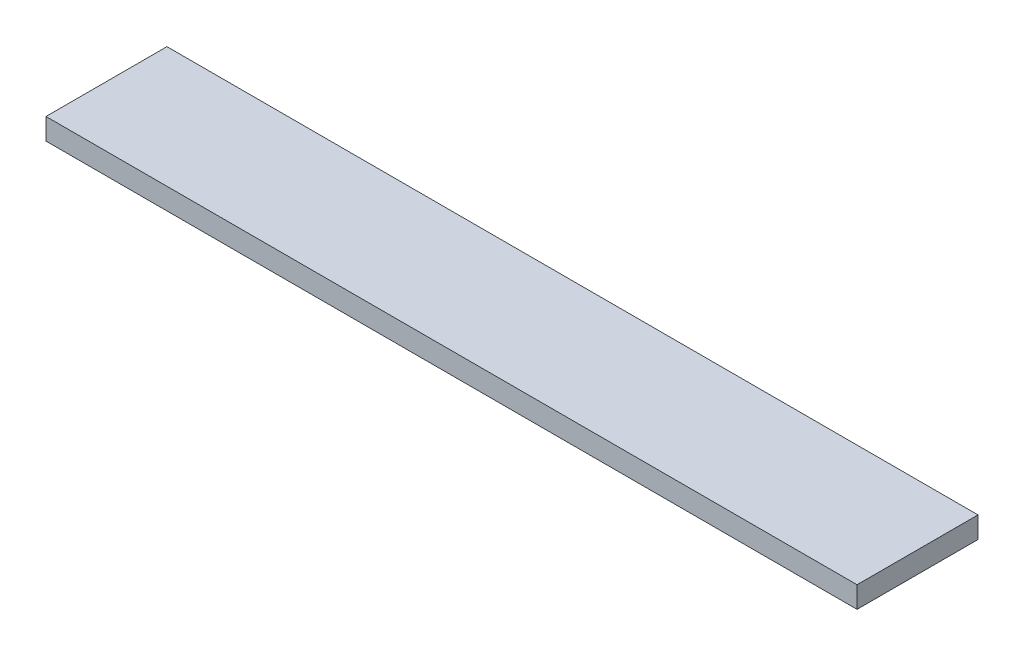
SolidWorks part; units mm, degrees
ref_plane "Alzado" through (0, 0, 0) normal (0, 0, 1) x (1, 0, 0)
ref_plane "Planta" through (0, 0, 0) normal (0, 1, 0) x (1, 0, 0)
ref_plane "Vista lateral" through (0, 0, 0) normal (1, 0, 0) x (0, 0, -1)
sketch "Croquis2" plane through (0, 0, 0) normal (0, 1, 0) x (1, 0, 0)
  line L1 (-285, 42.5) -> (285, 42.5)
  line L2 (-285, 42.5) -> (-285, -42.5)
  line L3 (-285, -42.5) -> (285, -42.5)
  line L4 (285, 42.5) -> (285, -42.5)
  line L5 (-285, 42.5) -> (285, -42.5) construction
  line L6 (-285, -42.5) -> (285, 42.5) construction
  point P0 (0, 0)
  dimension "D1" = 570
  dimension "D2" = 85
extrude "Saliente-Extruir1" add sketch "Croquis2" along normal blind 15
